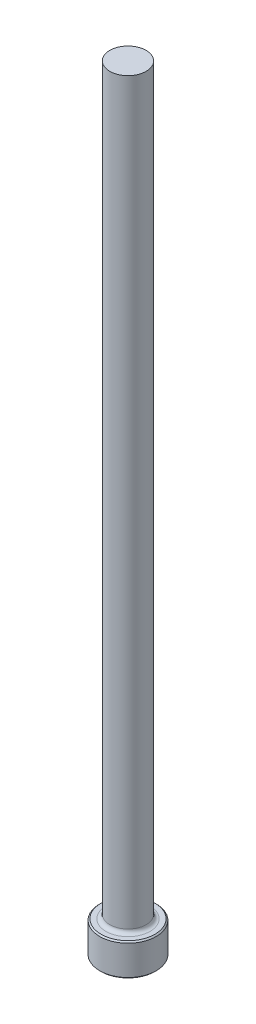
SolidWorks part; units mm, degrees
ref_plane "Front Plane" through (0, 0, 0) normal (0, 0, 1) x (1, 0, 0)
ref_plane "Top Plane" through (0, 0, 0) normal (0, 1, 0) x (1, 0, 0)
ref_plane "Right Plane" through (0, 0, 0) normal (1, 0, 0) x (0, 0, -1)
sketch "Sketch1" plane through (0, 0, 0) normal (0, 0, 1) x (1, 0, 0)
  line L0 (0, 259.9588) -> (0, -15.1925) construction
  line L1 (0, 0) -> (-5.5499, 0)
  line L2 (-5.5499, 0) -> (-5.5499, 6.35)
  line L3 (-5.5499, 6.35) -> (-3.5712, 6.35)
  line L4 (-3.5712, 6.35) -> (-3.5712, 152.4)
  line L5 (-3.5712, 152.4) -> (0, 152.4)
  line L6 (0, 152.4) -> (0, 0)
  dimension "L" = 152.4
  dimension "H" = 11.0998
  dimension "T" = 6.35
  dimension "D" = 7.1425
revolve "Revolve1" add sketch "Sketch1" angle 360 about L0
chamfer "Chamfer1" distance 0.254 angle 45 2 edges at (0, 6.35, 5.5499) (0, 0, 5.5499)
fillet "Fillet1" radius 0.762 1 edges at (0, 6.35, 3.5712)
sketch "Pocket Sketch" plane through (0, 0, 0) normal (0, 0, 1) x (1, 0, 0)
  line L0 (-5.9468, 0) -> (-5.9468, 6.3754)
  line L1 (-5.9468, 6.3754) -> (-4.7301, 6.3754)
  line L2 (-3.9681, 7.1374) -> (-3.9681, 22.225)
  line L3 (-3.9681, 22.225) -> (0, 22.225)
  line L4 (0, 22.225) -> (0, 0)
  line L5 (0, 0) -> (-5.9468, 0)
  line L6 (0, 12.6104) -> (0, -2.4989) construction
  line L7 (-5.5499, 6.096) -> (-5.5499, 0.254) construction
  line L8 (5.2959, 6.35) -> (-5.2959, 6.35) construction
  line L9 (-3.5712, 152.4) -> (-3.5712, 7.112) construction
  line L10 (-4.7301, 6.3754) -> (-3.9681, 7.1374)
  point P3 (-3.9681, 6.3754)
  dimension "D1" = 11.8935
  dimension "D2" = 0.3969
  dimension "D3" = 0.0254
  dimension "D4" = 0.3969
  dimension "D5" = 7.9362
  dimension "D6" = 22.225
